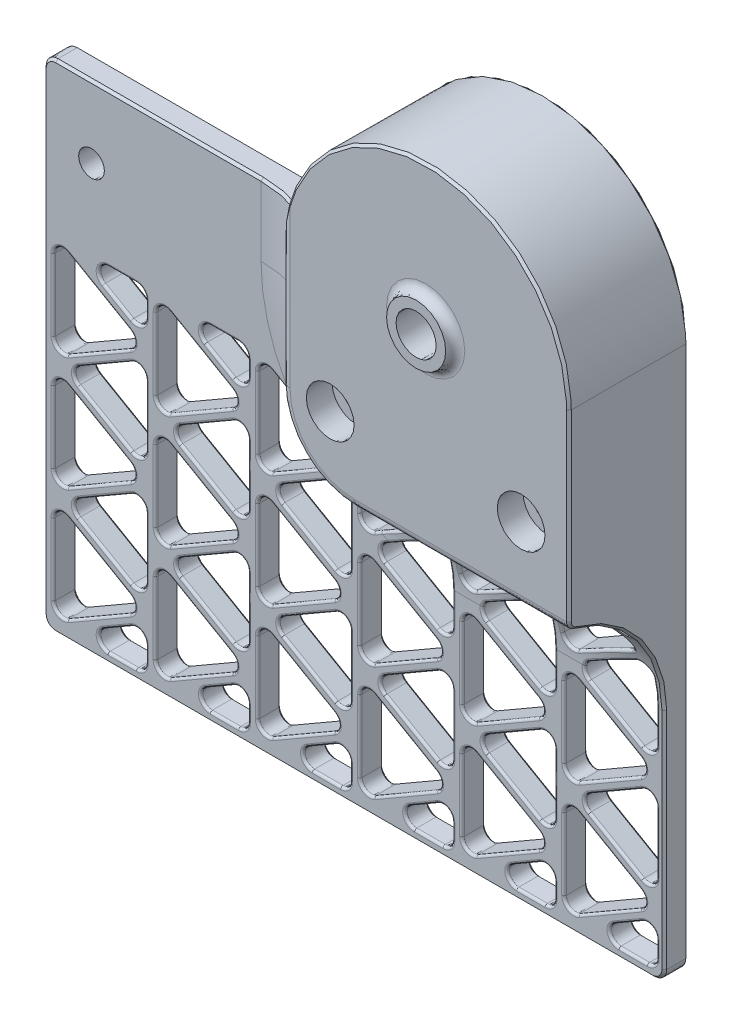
SolidWorks part; units mm, degrees
ref_plane "Płaszczyzna przednia" through (0, 0, 0) normal (0, 0, 1) x (1, 0, 0)
ref_plane "Płaszczyzna górna" through (0, 0, 0) normal (0, 1, 0) x (1, 0, 0)
ref_plane "Płaszczyzna prawa" through (0, 0, 0) normal (1, 0, 0) x (0, 0, -1)
sketch "Szkic1" plane through (0, 0, 0) normal (0, 0, 1) x (1, 0, 0)
  line L0 (0, 0) -> (0, 40)
  line L1 (0, 0) -> (60, 0)
  line L2 (60, 0) -> (60, 40)
  arc A0 (0, 40) -> (60, 40) centre (30, 40) cw
  dimension "D1" = 60
  dimension "D2" = 40
extrude "Dodanie-wyciągnięcie1" add sketch "Szkic1" along normal blind 25
sketch "Szkic2" plane through (0, 0, 25) normal (0, 0, 1) x (1, 0, 0)
  line L0 (10, 15) -> (50, 15) construction
  line L1 (30, 15) -> (30, 0) construction
  line L2 (0, 0) -> (60, 0) construction
  line L3 (0, 40) -> (0, 0) construction
  dimension "D1" = 15
  dimension "D2" = 10
hole_wizard "Pogłębienie walcowe pod M5 Wkręt z łbem walcowym z gniazdem sześciokątnym1" positions "Szkic3" profile "Szkic4" counterbore size "M5" standard "DIN"
sketch "Szkic3" plane through (0, 0, 25) normal (0, 0, 1) x (1, 0, 0)
  point P0 (10, 15)
  point P3 (50, 15)
sketch "Szkic4" plane through (10, 15, 25) normal (1, 0, 0) x (0, -1, 0)
  line L0 (0, 0) -> (0, 25)
  line L1 (0, 25) -> (2.75, 25)
  line L3 (2.75, 25) -> (2.75, 5.4)
  line L4 (2.75, 5.4) -> (5, 5.4)
  line L5 (5, 5.4) -> (5, 0)
  line L7 (5, 0) -> (0, 0)
  line L11 (0, -6.35) -> (0, 107.95) construction
  dimension "Średnica otworu na wylot" = 5.5
  dimension "Głębokość otworu na wylot" = 25
  dimension "Średnica pogłębienia walcowego" = 10
  dimension "Głębokość pogłębienia walcowego" = 5.4
hole_wizard "Otwór pod śrubę M81" positions "Szkic5" profile "Szkic6" hole size "M8" standard "DIN"
sketch "Szkic5" plane through (0, 0, 25) normal (0, 0, 1) x (1, 0, 0)
  point P0 (30, 40)
sketch "Szkic6" plane through (30, 40, 25) normal (1, 0, 0) x (0, -1, 0)
  line L0 (0, 0) -> (0, 25)
  line L1 (0, 25) -> (4.2, 25)
  line L2 (4.2, 25) -> (4.2, 0)
  line L5 (4.2, 0) -> (0, 0)
  line L11 (0, -6.35) -> (0, 107.95) construction
  dimension "Średnica otworu na wylot" = 8.4
  dimension "Głębokość otworu na wylot" = 25
sketch "Szkic7" plane through (0, 0, 0) normal (0, -1, 0) x (1, 0, 0)
  line L0 (60, 25) -> (60, 0) construction
  line L1 (0, 0) -> (60, 0)
  line L2 (0, 0) -> (0, 5)
  line L3 (0, 5) -> (60, 5)
  line L4 (60, 0) -> (60, 5)
  dimension "D1" = 5
extrude "Dodanie-wyciągnięcie2" add sketch "Szkic7" along normal blind 74
sketch "Szkic9" plane through (0, 0, 0) normal (-1, 0, 0) x (0, 0, 1)
  line L0 (0, 40) -> (0, -74) construction
  line L1 (5, -74) -> (0, -74)
  line L2 (5, -74) -> (5, 30)
  line L3 (5, 30) -> (0, 30)
  line L4 (0, -74) -> (0, 30)
  line L5 (25, 0) -> (5, 0) construction
  dimension "D1" = 30
extrude "Dodanie-wyciągnięcie3" add sketch "Szkic9" along normal blind 70
fillet "Zaokrąglenie1" radius 15 1 edges at (0, 0, 15)
fillet "Zaokrąglenie2" radius 25 3 edges at (37.5, 0, 5) (4.3934, 4.3934, 5) (0, 22.5, 5)
fillet "Zaokrąglenie3" radius 10 1 edges at (0, 30, 12.5)
fillet "Zaokrąglenie4" radius 2.5 3 edges at (60, -74, 2.5) (-70, -74, 2.5) (-70, 30, 2.5)
sketch "Szkic10" plane through (0, 0, 5) normal (0, 0, 1) x (1, 0, 0)
  line L0 (10, 15) -> (-60, 15) construction
  line L1 (-70, -71.5) -> (-70, 27.5) construction
  circle A0 centre (-60, 15) radius 2.7
  dimension "D1" = 5.4
  dimension "D2" = 10
extrude "Wytnij-wyciągnięcie2" cut sketch "Szkic10" against normal through all
sketch "Szkic12" plane through (0, 0, 0) normal (0, 0, -1) x (-1, 0, 0)
  line L1 (-30, 47.7365) -> (-36.7, 43.8682)
  line L2 (-36.7, 43.8682) -> (-36.7, 36.1318)
  line L3 (-36.7, 36.1318) -> (-30, 32.2635)
  line L4 (-30, 32.2635) -> (-23.3, 36.1318)
  line L5 (-23.3, 36.1318) -> (-23.3, 43.8682)
  line L6 (-23.3, 43.8682) -> (-30, 47.7365)
  circle A0 centre (-30, 40) radius 6.7 construction
  dimension "D1" = 13.4
extrude "Wytnij-wyciągnięcie3" cut sketch "Szkic12" against normal blind 8
chamfer "Sfazowanie1" distance 1.2 angle 65 1 edges at (25.8, 40, 8)
sketch "Szkic13" plane through (0, 0, 25) normal (0, 0, 1) x (1, 0, 0)
  circle A0 centre (30, 40) radius 6.2
  circle A1 centre (30, 40) radius 4.2 construction
  circle A2 centre (30, 40) radius 4.2
  dimension "D1" = 12.4
extrude "Dodanie-wyciągnięcie4" add sketch "Szkic13" along normal blind 2
fillet "Zaokrąglenie5" radius 2 1 edges at (23.8, 40, 25)
sketch "Szkic14" plane through (0, 0, 5) normal (0, 0, 1) x (1, 0, 0)
  line L0 (-70, 0) -> (60, 0) construction
  line L1 (-70, -71.5) -> (-70, 27.5) construction
  line L2 (60, -24.4949) -> (60, 0) construction
  line L3 (-67.5, 30) -> (-24.4949, 30) construction
  line L4 (-68, -2) -> (-68, -24)
  line L5 (-68, -24) -> (-48.9474, -13)
  line L6 (-48.9474, -13) -> (-68, -2)
  line L7 (-70, -25) -> (-36.4444, -25) construction
  line L8 (-48.9474, -37) -> (-68, -48)
  line L9 (-68, -26) -> (-48.9474, -37)
  line L10 (-68, -48) -> (-68, -26)
  line L11 (-70, -49) -> (-35.1964, -49) construction
  line L12 (-68, -50) -> (-68, -72)
  line L13 (-68, -72) -> (-48.9474, -61)
  line L14 (-48.9474, -61) -> (-68, -50)
  line L15 (57.5, -74) -> (-67.5, -74) construction
  line L16 (-46.6, -2) -> (-46.6, -24)
  line L17 (-46.6, -24) -> (-27.5474, -13)
  line L18 (-27.5474, -13) -> (-46.6, -2)
  line L19 (-27.5474, -37) -> (-46.6, -48)
  line L20 (-46.6, -26) -> (-27.5474, -37)
  line L21 (-46.6, -48) -> (-46.6, -26)
  line L22 (-46.6, -50) -> (-46.6, -72)
  line L23 (-46.6, -72) -> (-27.5474, -61)
  line L24 (-27.5474, -61) -> (-46.6, -50)
  line L25 (-25.2, -2) -> (-25.2, -24)
  line L26 (-25.2, -24) -> (-6.1474, -13)
  line L27 (-6.1474, -13) -> (-25.2, -2)
  line L28 (-6.1474, -37) -> (-25.2, -48)
  line L29 (-25.2, -26) -> (-6.1474, -37)
  line L30 (-25.2, -48) -> (-25.2, -26)
  line L31 (-25.2, -50) -> (-25.2, -72)
  line L32 (-25.2, -72) -> (-6.1474, -61)
  line L33 (-6.1474, -61) -> (-25.2, -50)
  line L34 (-3.8, -2) -> (-3.8, -24)
  line L35 (-3.8, -24) -> (15.2526, -13)
  line L36 (15.2526, -13) -> (-3.8, -2)
  line L37 (15.2526, -37) -> (-3.8, -48)
  line L38 (-3.8, -26) -> (15.2526, -37)
  line L39 (-3.8, -48) -> (-3.8, -26)
  line L40 (-3.8, -50) -> (-3.8, -72)
  line L41 (-3.8, -72) -> (15.2526, -61)
  line L42 (15.2526, -61) -> (-3.8, -50)
  line L43 (17.6, -2) -> (17.6, -24)
  line L44 (17.6, -24) -> (36.6526, -13)
  line L45 (36.6526, -13) -> (17.6, -2)
  line L46 (36.6526, -37) -> (17.6, -48)
  line L47 (17.6, -26) -> (36.6526, -37)
  line L48 (17.6, -48) -> (17.6, -26)
  line L49 (17.6, -50) -> (17.6, -72)
  line L50 (17.6, -72) -> (36.6526, -61)
  line L51 (36.6526, -61) -> (17.6, -50)
  line L52 (39, -2) -> (39, -24)
  line L53 (39, -24) -> (58.0526, -13)
  line L54 (58.0526, -13) -> (39, -2)
  line L55 (58.0526, -37) -> (39, -48)
  line L56 (39, -26) -> (58.0526, -37)
  line L57 (39, -48) -> (39, -26)
  line L58 (39, -50) -> (39, -72)
  line L59 (39, -72) -> (58.0526, -61)
  line L60 (58.0526, -61) -> (39, -50)
  dimension "D1" = 30
  dimension "D2" = 2
  dimension "D3" = 2
  dimension "D4" = 22
  dimension "D5" = 2
  dimension "D6" = 2
  dimension "D7" = 2
  dimension "D8" = 6
extrude "Wytnij-wyciągnięcie4" cut sketch "Szkic14" against normal through all both and the other way through all
sketch "Szkic15" plane through (0, 0, 5) normal (0, 0, 1) x (1, 0, 0)
  line L0 (-70, 0) -> (60, 0) construction
  line L1 (-70, -71.5) -> (-70, 27.5) construction
  line L2 (60, 0) -> (60, 40) construction
  line L3 (-67.5, 30) -> (-24.4949, 30) construction
  line L4 (-64, -2) -> (-48.6, -10.8912)
  line L5 (-48.6, -10.8912) -> (-48.6, -2)
  line L6 (-48.6, -2) -> (-64, -2)
  line L7 (-46.6, -24) -> (-46.6, -2) construction
  line L8 (-68, -2) -> (-48.9474, -13) construction
  line L12 (-48.6, -15.1088) -> (-65.7321, -25)
  line L13 (-65.7321, -25) -> (-48.6, -34.8912)
  line L14 (-48.6, -34.8912) -> (-48.6, -15.1088)
  line L15 (-48.9474, -13) -> (-68, -24) construction
  line L16 (-68, -26) -> (-48.9474, -37) construction
  line L17 (-46.6, -48) -> (-46.6, -26) construction
  line L18 (-68, -37) -> (60, -37) construction
  line L19 (-68, -48) -> (-68, -26) construction
  line L20 (60, -71.5) -> (60, -24.4949) construction
  line L21 (-48.6, -39.1088) -> (-48.6, -58.8912)
  line L22 (-65.7321, -49) -> (-48.6, -39.1088)
  line L23 (-48.6, -58.8912) -> (-65.7321, -49)
  line L24 (-48.6, -72) -> (-64, -72)
  line L25 (-48.6, -63.1088) -> (-48.6, -72)
  line L26 (-64, -72) -> (-48.6, -63.1088)
  line L27 (-42.6, -2) -> (-27.2, -10.8912)
  line L28 (-27.2, -10.8912) -> (-27.2, -2)
  line L29 (-27.2, -2) -> (-42.6, -2)
  line L30 (-27.2, -15.1088) -> (-44.3321, -25)
  line L31 (-44.3321, -25) -> (-27.2, -34.8912)
  line L32 (-27.2, -34.8912) -> (-27.2, -15.1088)
  line L33 (-27.2, -39.1088) -> (-27.2, -58.8912)
  line L34 (-44.3321, -49) -> (-27.2, -39.1088)
  line L35 (-27.2, -58.8912) -> (-44.3321, -49)
  line L36 (-27.2, -72) -> (-42.6, -72)
  line L37 (-27.2, -63.1088) -> (-27.2, -72)
  line L38 (-42.6, -72) -> (-27.2, -63.1088)
  line L39 (-21.2, -2) -> (-5.8, -10.8912)
  line L40 (-5.8, -10.8912) -> (-5.8, -2)
  line L41 (-5.8, -2) -> (-21.2, -2)
  line L42 (-5.8, -15.1088) -> (-22.9321, -25)
  line L43 (-22.9321, -25) -> (-5.8, -34.8912)
  line L44 (-5.8, -34.8912) -> (-5.8, -15.1088)
  line L45 (-5.8, -39.1088) -> (-5.8, -58.8912)
  line L46 (-22.9321, -49) -> (-5.8, -39.1088)
  line L47 (-5.8, -58.8912) -> (-22.9321, -49)
  line L48 (-5.8, -72) -> (-21.2, -72)
  line L49 (-5.8, -63.1088) -> (-5.8, -72)
  line L50 (-21.2, -72) -> (-5.8, -63.1088)
  line L51 (0.2, -2) -> (15.6, -10.8912)
  line L52 (15.6, -10.8912) -> (15.6, -2)
  line L53 (15.6, -2) -> (0.2, -2)
  line L54 (15.6, -15.1088) -> (-1.5321, -25)
  line L55 (-1.5321, -25) -> (15.6, -34.8912)
  line L56 (15.6, -34.8912) -> (15.6, -15.1088)
  line L57 (15.6, -39.1088) -> (15.6, -58.8912)
  line L58 (-1.5321, -49) -> (15.6, -39.1088)
  line L59 (15.6, -58.8912) -> (-1.5321, -49)
  line L60 (15.6, -72) -> (0.2, -72)
  line L61 (15.6, -63.1088) -> (15.6, -72)
  line L62 (0.2, -72) -> (15.6, -63.1088)
  line L63 (21.6, -2) -> (37, -10.8912)
  line L64 (37, -10.8912) -> (37, -2)
  line L65 (37, -2) -> (21.6, -2)
  line L66 (37, -15.1088) -> (19.8679, -25)
  line L67 (19.8679, -25) -> (37, -34.8912)
  line L68 (37, -34.8912) -> (37, -15.1088)
  line L69 (37, -39.1088) -> (37, -58.8912)
  line L70 (19.8679, -49) -> (37, -39.1088)
  line L71 (37, -58.8912) -> (19.8679, -49)
  line L72 (37, -72) -> (21.6, -72)
  line L73 (37, -63.1088) -> (37, -72)
  line L74 (21.6, -72) -> (37, -63.1088)
  line L75 (43, -2) -> (58.4, -10.8912)
  line L76 (58.4, -10.8912) -> (58.4, -2)
  line L77 (58.4, -2) -> (43, -2)
  line L78 (58.4, -15.1088) -> (41.2679, -25)
  line L79 (41.2679, -25) -> (58.4, -34.8912)
  line L80 (58.4, -34.8912) -> (58.4, -15.1088)
  line L81 (58.4, -39.1088) -> (58.4, -58.8912)
  line L82 (41.2679, -49) -> (58.4, -39.1088)
  line L83 (58.4, -58.8912) -> (41.2679, -49)
  line L84 (58.4, -72) -> (43, -72)
  line L85 (58.4, -63.1088) -> (58.4, -72)
  line L86 (43, -72) -> (58.4, -63.1088)
  dimension "D1" = 30
  dimension "D2" = 2
  dimension "D3" = 2
  dimension "D4" = 2
  dimension "D5" = 2
  dimension "D6" = 2
  dimension "D7" = 2
  dimension "D8" = 6
extrude "Wytnij-wyciągnięcie5" cut sketch "Szkic15" against normal through all both and the other way through all
fillet "Zaokrąglenie6" radius 2 24 edges at (43, -72, 2.5) (21.6, -72, 2.5) (0.2, -72, 2.5) (-21.2, -72, 2.5) (-42.6, -72, 2.5) (-64, -72, 2.5) (41.2679, -49, 2.5) (41.2679, -25, 2.5) (19.8679, -49, 2.5) (19.8679, -25, 2.5) (-1.5321, -49, 2.5) (-1.5321, -25, 2.5) (-22.9321, -49, 2.5) (-22.9321, -25, 2.5) (-44.3321, -25, 2.5) (-44.3321, -49, 2.5) (-65.7321, -25, 2.5) (-65.7321, -49, 2.5) (43, -2, 9.5461) (21.6, -2, 9.5461) (0.2, -2, 5.8141) (-21.2, -2, 2.5) (-42.6, -2, 2.5) (-64, -2, 2.5)
fillet "Zaokrąglenie7" radius 2 18 edges at (58.0526, -61, 2.5) (58.0526, -37, 2.5) (58.0526, -13, 3.8997) (36.6526, -13, 3.8997) (36.6526, -37, 2.5) (36.6526, -61, 2.5) (15.2526, -61, 2.5) (15.2526, -37, 2.5) (15.2526, -13, 3.8997) (-6.1474, -13, 2.6957) (-6.1474, -37, 2.5) (-6.1474, -61, 2.5) (-27.5474, -61, 2.5) (-27.5474, -37, 2.5) (-27.5474, -13, 2.5) (-48.9474, -13, 2.5) (-48.9474, -37, 2.5) (-48.9474, -61, 2.5)
fillet "Zaokrąglenie8" radius 2 18 edges at (39, -50, 2.5) (17.6, -50, 2.5) (-3.8, -50, 2.5) (-25.2, -50, 2.5) (-46.6, -50, 2.5) (-68, -50, 2.5) (-68, -26, 2.5) (-46.6, -26, 2.5) (-25.2, -26, 2.5) (39, -26, 2.5) (17.6, -26, 2.5) (-3.8, -26, 2.5) (39, -2, 9.5461) (17.6, -2, 9.5461) (-3.8, -2, 4.6944) (-25.2, -2, 2.5) (-46.6, -2, 2.5) (-68, -2, 2.5)
fillet "Zaokrąglenie9" radius 2 18 edges at (39, -24, 2.5024) (17.6, -24, 2.5024) (-3.8, -24, 2.5) (-25.2, -24, 2.5) (-46.6, -48, 2.5) (-25.2, -48, 2.5) (-3.8, -48, 2.5) (17.6, -48, 2.5) (39, -48, 2.5) (39, -72, 2.5) (17.6, -72, 2.5) (-3.8, -72, 2.5) (-25.2, -72, 2.5) (-46.6, -72, 2.5) (-68, -72, 2.5) (-68, -48, 2.5) (-46.6, -24, 2.5) (-68, -24, 2.5)
fillet "Zaokrąglenie10" radius 2 24 edges at (-48.6, -10.8912, 2.5) (-27.2, -10.8912, 2.5) (-5.8, -10.8912, 2.9013) (15.6, -10.8912, 4.5126) (37, -10.8912, 4.5126) (-48.6, -34.8912, 2.5) (-27.2, -34.8912, 2.5) (-5.8, -34.8912, 2.5) (15.6, -34.8912, 2.5) (37, -34.8912, 2.5) (37, -58.8912, 2.5) (15.6, -58.8912, 2.5) (-5.8, -58.8912, 2.5) (-27.2, -58.8912, 2.5) (-48.6, -58.8912, 2.5) (-48.6, -72, 2.5) (-27.2, -72, 2.5) (-5.8, -72, 2.5) (15.6, -72, 2.5) (37, -72, 2.5) (58.4, -72, 2.5) (58.4, -58.8912, 2.5) (58.4, -34.8912, 2.5) (58.4, -10.8912, 4.5126)
fillet "Zaokrąglenie11" radius 2 24 edges at (-48.6, -2, 2.5) (-48.6, -15.1088, 2.5) (-27.2, -2, 2.5) (-27.2, -15.1088, 2.5) (-48.6, -39.1088, 2.5) (-48.6, -63.1088, 2.5) (-27.2, -39.1088, 2.5) (-27.2, -63.1088, 2.5) (15.6, -63.1088, 2.5) (-5.8, -63.1088, 2.5) (-5.8, -39.1088, 2.5) (-5.8, -15.1088, 2.5844) (15.6, -39.1088, 2.5) (37, -39.1088, 2.5) (37, -63.1088, 2.5) (58.4, -63.1088, 2.5) (58.4, -39.1088, 2.5) (37, -15.1088, 3.4144) (15.6, -15.1088, 3.4144) (-5.8, -2, 4.2129) (15.6, -2, 9.5461) (37, -2, 9.5461) (58.4, -15.1088, 3.4144) (58.4, -2, 9.5461)
chamfer "Sfazowanie2" distance 0.5 angle 45 270 edges at (30, 70, 0) (-2.9289, 32.9289, 0) (-38.75, 30, 0) (-69.2678, 29.2678, 0) (-70, -22, 0) (-69.2678, -73.2678, 0) (-5, -74, 0) (59.2678, -73.2678, 0) (60, -15.75, 0) (52.75, 15, 0) (12.75, 15, 0) (-57.3, 15, 0) (33.35, 45.8024, 0) (36.7, 40, 0) (33.35, 34.1976, 0) (26.65, 34.1976, 0) (23.3, 40, 0) (26.65, 45.8024, 0) (-67, -3.7321, 0) (-58.4737, -7.5, 0) (-50.9474, -13, 0) (-58.4737, -18.5, 0) (-67, -22.2679, 0) (-68, -13, 0) (40, -51.7321, 0) (48.5263, -55.5, 0) (56.0526, -61, 0) (48.5263, -66.5, 0) (40, -70.2679, 0) (39, -61, 0) (18.6, -3.7321, 0) (27.1263, -7.5, 0) (34.6526, -13, 0) (27.1263, -18.5, 0) (18.6, -22.2679, 0) (17.6, -13, 0) (-2.8, -51.7321, 0) (5.7263, -55.5, 0) (13.2526, -61, 0) (5.7263, -66.5, 0) (-2.8, -70.2679, 0) (-3.8, -61, 0) (-2.8, -27.7321, 0) (5.7263, -31.5, 0) (13.2526, -37, 0) (5.7263, -42.5, 0) (-2.8, -46.2679, 0) (-3.8, -37, 0) (-2.8, -3.7321, 0) (5.7263, -7.5, 0) (13.2526, -13, 0) (5.7263, -18.5, 0) (-2.8, -22.2679, 0) (-3.8, -13, 0) (18.6, -27.7321, 0) (27.1263, -31.5, 0) (34.6526, -37, 0) (27.1263, -42.5, 0) (18.6, -46.2679, 0) (17.6, -37, 0) (18.6, -51.7321, 0) (27.1263, -55.5, 0) (34.6526, -61, 0) (27.1263, -66.5, 0) (18.6, -70.2679, 0) (17.6, -61, 0) (40, -3.7321, 0) (48.5263, -7.5, 0) (56.0526, -13, 0) (48.5263, -18.5, 0) (40, -22.2679, 0) (39, -13, 0) (40, -27.7321, 0) (48.5263, -31.5, 0) (56.0526, -37, 0) (48.5263, -42.5, 0) (40, -46.2679, 0) (39, -37, 0) (-67, -27.7321, 0) (-58.4737, -31.5, 0) (-50.9474, -37, 0) (-58.4737, -42.5, 0) (-67, -46.2679, 0) (-68, -37, 0) (-67, -51.7321, 0) (-58.4737, -55.5, 0) (-50.9474, -61, 0) (-58.4737, -66.5, 0) (-67, -70.2679, 0) (-68, -61, 0) (-45.6, -3.7321, 0) (-37.0737, -7.5, 0) (-29.5474, -13, 0) (-37.0737, -18.5, 0) (-45.6, -22.2679, 0) (-46.6, -13, 0) (-45.6, -27.7321, 0) (-37.0737, -31.5, 0) (-29.5474, -37, 0) (-37.0737, -42.5, 0) (-45.6, -46.2679, 0) (-46.6, -37, 0) (-24.2, -51.7321, 0) (-15.6737, -55.5, 0) (-8.1474, -61, 0) (-15.6737, -66.5, 0) (-24.2, -70.2679, 0) (-25.2, -61, 0) (-24.2, -27.7321, 0) (-15.6737, -31.5, 0) (-8.1474, -37, 0) (-15.6737, -42.5, 0) (-24.2, -46.2679, 0) (-25.2, -37, 0) (-24.2, -3.7321, 0) (-15.6737, -7.5, 0) (-8.1474, -13, 0) (-15.6737, -18.5, 0) (-24.2, -22.2679, 0) (-25.2, -13, 0) (-45.6, -51.7321, 0) (-37.0737, -55.5, 0) (-29.5474, -61, 0) (-37.0737, -66.5, 0) (-45.6, -70.2679, 0) (-46.6, -61, 0) (-49.6, -9.1591, 0) (-54.5679, -7.4456, 0) (-58.4678, -3.4824, 0) (-53.5679, -2, 0) (-49.1858, -2.5858, 0) (-48.6, -5.7135, 0) (57.4, -9.1591, 0) (52.4321, -7.4456, 0) (48.5322, -3.4824, 0) (53.4321, -2, 0) (57.8142, -2.5858, 0) (58.4, -5.7135, 0) (27.1322, -70.5176, 0) (31.0321, -66.5544, 0) (36, -64.8409, 0) (37, -68.2865, 0) (36.4142, -71.4142, 0) (32.0321, -72, 0) (36, -57.1591, 0) (28.434, -53.9456, 0) (21.8679, -49, 0) (28.434, -44.0544, 0) (36, -40.8409, 0) (37, -49, 0) (21.8679, -25, 0) (28.434, -20.0544, 0) (36, -16.8409, 0) (37, -25, 0) (36, -33.1591, 0) (28.434, -29.9456, 0) (43.2679, -25, 0) (49.834, -20.0544, 0) (57.4, -16.8409, 0) (58.4, -25, 0) (57.4, -33.1591, 0) (49.834, -29.9456, 0) (57.4, -57.1591, 0) (49.834, -53.9456, 0) (43.2679, -49, 0) (49.834, -44.0544, 0) (57.4, -40.8409, 0) (58.4, -49, 0) (48.5322, -70.5176, 0) (52.4321, -66.5544, 0) (57.4, -64.8409, 0) (58.4, -68.2865, 0) (57.8142, -71.4142, 0) (53.4321, -72, 0) (-42.3321, -25, 0) (-35.766, -20.0544, 0) (-28.2, -16.8409, 0) (-27.2, -25, 0) (-28.2, -33.1591, 0) (-35.766, -29.9456, 0) (-28.2, -57.1591, 0) (-35.766, -53.9456, 0) (-42.3321, -49, 0) (-35.766, -44.0544, 0) (-28.2, -40.8409, 0) (-27.2, -49, 0) (-37.0678, -70.5176, 0) (-33.1679, -66.5544, 0) (-28.2, -64.8409, 0) (-27.2, -68.2865, 0) (-27.7858, -71.4142, 0) (-32.1679, -72, 0) (-6.8, -9.1591, 0) (-11.7679, -7.4456, 0) (-15.6678, -3.4824, 0) (-10.7679, -2, 0) (-6.3858, -2.5858, 0) (-5.8, -5.7135, 0) (-63.7321, -25, 0) (-57.166, -20.0544, 0) (-49.6, -16.8409, 0) (-48.6, -25, 0) (-49.6, -33.1591, 0) (-57.166, -29.9456, 0) (-49.6, -57.1591, 0) (-57.166, -53.9456, 0) (-63.7321, -49, 0) (-57.166, -44.0544, 0) (-49.6, -40.8409, 0) (-48.6, -49, 0) (-58.4678, -70.5176, 0) (-54.5679, -66.5544, 0) (-49.6, -64.8409, 0) (-48.6, -68.2865, 0) (-49.1858, -71.4142, 0) (-53.5679, -72, 0) (-28.2, -9.1591, 0) (-33.1679, -7.4456, 0) (-37.0678, -3.4824, 0) (-32.1679, -2, 0) (-27.7858, -2.5858, 0) (-27.2, -5.7135, 0) (0.4679, -25, 0) (7.034, -20.0544, 0) (14.6, -16.8409, 0) (15.6, -25, 0) (14.6, -33.1591, 0) (7.034, -29.9456, 0) (14.6, -57.1591, 0) (7.034, -53.9456, 0) (0.4679, -49, 0) (7.034, -44.0544, 0) (14.6, -40.8409, 0) (15.6, -49, 0) (5.7322, -70.5176, 0) (9.6321, -66.5544, 0) (14.6, -64.8409, 0) (15.6, -68.2865, 0) (15.0142, -71.4142, 0) (10.6321, -72, 0) (36, -9.1591, 0) (31.0321, -7.4456, 0) (27.1322, -3.4824, 0) (32.0321, -2, 0) (36.4142, -2.5858, 0) (37, -5.7135, 0) (-20.9321, -25, 0) (-14.366, -20.0544, 0) (-6.8, -16.8409, 0) (-5.8, -25, 0) (-6.8, -33.1591, 0) (-14.366, -29.9456, 0) (-6.8, -57.1591, 0) (-14.366, -53.9456, 0) (-20.9321, -49, 0) (-14.366, -44.0544, 0) (-6.8, -40.8409, 0) (-5.8, -49, 0) (-15.6678, -70.5176, 0) (-11.7679, -66.5544, 0) (-6.8, -64.8409, 0) (-5.8, -68.2865, 0) (-6.3858, -71.4142, 0) (-10.7679, -72, 0) (14.6, -9.1591, 0) (9.6321, -7.4456, 0) (5.7322, -3.4824, 0) (10.6321, -2, 0) (15.0142, -2.5858, 0) (15.6, -5.7135, 0)
chamfer "Sfazowanie4" distance 0.5 angle 45 2 edges at (60, 20, 25) (30, 70, 25)
fillet "Zaokrąglenie12" radius 0.5 67 edges at (57.8142, -71.4142, 5) (58.4, -68.2865, 5) (36.4142, -71.4142, 5) (40, -70.2679, 5) (18.6, -70.2679, 5) (5.7263, -66.5, 5) (5.7263, -55.5, 5) (37, -49, 5) (49.834, -44.0544, 5) (57.4, -57.1591, 5) (39, -37, 5) (40, -46.2679, 5) (17.6, -37, 5) (13.8507, -16.5887, 6.2761) (28.5005, -20.016, 5.4045) (22.0227, -25.7714, 5) (36, -33.1591, 5) (43.4227, -25.7714, 5) (49.834, -29.9456, 5) (40.0673, -22.3051, 5.0961) (18.6673, -22.3051, 5.0961) (27.2539, -18.4263, 5.7477) (34.6525, -12.9927, 7.8032) (30.9005, -7.3696, 11.7867) (-25.2, -37, 5) (-24.2, -46.2679, 5) (-14.366, -53.9456, 5) (-5.8, -49, 5) (-11.7679, -66.5544, 5) (-25.2, -61, 5) (-24.2, -70.2679, 5) (-33.1679, -66.5544, 5) (-58.4678, -70.5176, 5) (-49.1858, -71.4142, 5) (-45.6, -70.2679, 5) (-67, -51.7321, 5) (-67, -70.2679, 5) (-49.6, -40.8409, 5) (-29.5474, -37, 5) (-67, -46.2679, 5) (-57.166, -29.9456, 5) (-49.6, -33.1591, 5) (-20.9321, -25, 5) (-5.8, -25.0005, 5) (-8.6715, -16.7728, 5) (-16.2252, -18.8184, 5) (-20.3746, -4.786, 5) (-29.5474, -13, 5) (-37.0737, -7.5, 5) (-58.4678, -3.4824, 5) (-27.7858, -2.5858, 5) (13.2509, -12.9195, 7.8127) (-15.6512, -3.4241, 5.2802) (14.1375, -2.0736, 18.8978) (14.6, -64.8409, 5) (40, -51.7321, 5) (-2.8, -51.7321, 5) (27.1263, -31.5, 5) (5.7263, -31.5, 5) (32.0321, -2, 19.0922) (-48.6, -49, 5) (-48.6, -25, 5) (-2.7605, -3.7098, 9.0866)
fillet "Zaokrąglenie13" radius 2 3 edges at (0, 25.8992, 25) (37.25, 0, 25) (4.3934, 4.3934, 25)
chamfer "Sfazowanie5" distance 0.5 angle 45 13 edges at (60, -0.1177, 24.0542) (60, -9.2804, 10.1627) (60, -47.9974, 5) (59.2678, -73.2678, 5) (-5, -74, 5) (-69.2678, -73.2678, 5) (-0.2073, 37.9744, 23.8937) (-70, -22, 5) (-4.0356, 31.9735, 15.6328) (-69.2678, 29.2678, 5) (-16.8865, 30, 6.1859) (-45.9974, 30, 5)
